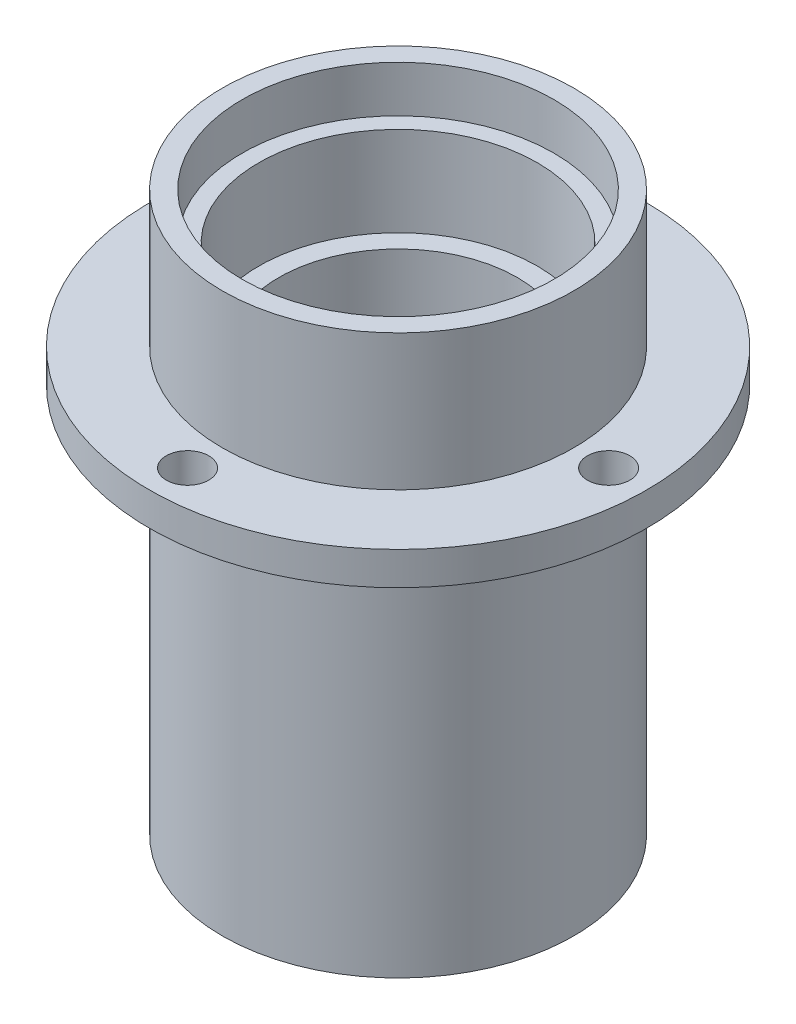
SolidWorks part; units mm, degrees
ref_plane "Plan de face" through (0, 0, 0) normal (0, 0, 1) x (1, 0, 0)
ref_plane "Plan de dessus" through (0, 0, 0) normal (0, 1, 0) x (1, 0, 0)
ref_plane "Plan de droite" through (0, 0, 0) normal (1, 0, 0) x (0, 0, -1)
sketch "Esquisse1" plane through (0, 0, 0) normal (1, 0, 0) x (0, 0, -1)
  line L0 (0, -31.915) -> (0, 51.1139) construction
  line L1 (23.5, 84.25) -> (23.5, 77.25)
  line L2 (23.5, 77.25) -> (21, 77.25)
  line L3 (23.5, 0) -> (23.5, 7)
  line L4 (23.5, 0) -> (26.5, 0)
  line L5 (26.5, 0) -> (26.5, 58.75)
  line L6 (26.5, 58.75) -> (37.5, 58.75)
  line L7 (37.5, 58.75) -> (37.5, 63.75)
  line L8 (37.5, 63.75) -> (26.5, 63.75)
  line L9 (26.5, 63.75) -> (26.5, 84.25)
  line L10 (26.5, 84.25) -> (23.5, 84.25)
  line L11 (23.5, 7) -> (21, 7)
  line L12 (21, 7) -> (21, 20.5)
  line L13 (21, 20.5) -> (18, 20.5)
  line L14 (18, 20.5) -> (18, 63.75)
  line L15 (18, 63.75) -> (21, 63.75)
  line L16 (21, 63.75) -> (21, 77.25)
  dimension "D1" = 3
  dimension "D2" = 2.5
  dimension "D3" = 7
  dimension "D4" = 58.75
  dimension "D5" = 20.5
  dimension "D6" = 5
  dimension "D7" = 11
  dimension "D8" = 11
  dimension "D9" = 3
  dimension "D10" = 7
  dimension "D11" = 13.5
  dimension "D12" = 43.25
  dimension "D13" = 3
  dimension "D14" = 3
  dimension "D15" = 23.5
  dimension "D16" = 18
  dimension "D17" = 23.5
  dimension "D18" = 2.5
revolve "Révolution1" add sketch "Esquisse1" angle 360 about L0
sketch "Esquisse2" plane through (0, 63.75, 0) normal (0, 1, 0) x (-1, 0, 0)
  line L0 (0, 0) -> (-40.6568, 0) construction
  circle A0 centre (-31.75, 0) radius 3.2
  circle A1 centre (0, 31.75) radius 3.2
  circle A2 centre (31.75, 0) radius 3.2
  circle A3 centre (0, -31.75) radius 3.2
  circle A9 centre (0, 0) radius 31.75 construction
  dimension "D2" = 6.4
  dimension "D1" = 63.5
extrude "passage vis" cut sketch "Esquisse2" against normal blind 10
